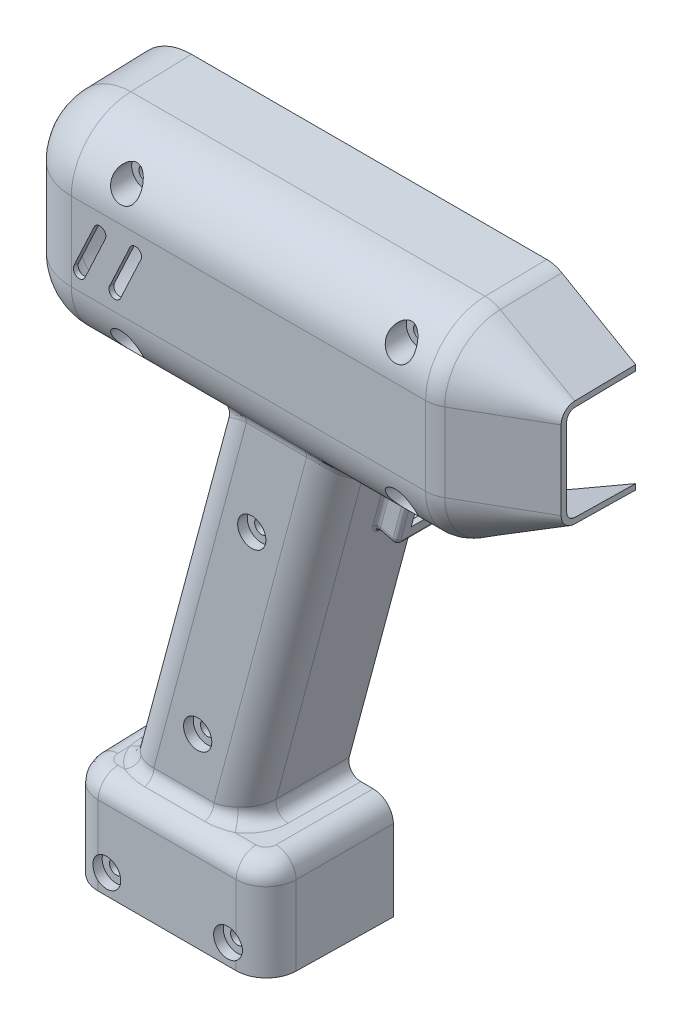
SolidWorks part; units mm, degrees
ref_plane "Ebene vorne" through (0, 0, 0) normal (0, 0, 1) x (1, 0, 0)
ref_plane "Ebene oben" through (0, 0, 0) normal (0, 1, 0) x (1, 0, 0)
ref_plane "Ebene rechts" through (0, 0, 0) normal (1, 0, 0) x (0, 0, -1)
sketch "Skizze1" plane through (0, 0, 0) normal (0, 0, 1) x (1, 0, 0)
  line L0 (55, 0) -> (-55, 0) construction
  line L1 (-25, 0) -> (25, 0)
  line L2 (-25, 0) -> (-25, 25)
  line L3 (-25, 25) -> (25, 25)
  line L4 (25, 0) -> (25, 25)
  line L5 (0, -9.5998) -> (0, 35.5758) construction
  line L6 (0, -55) -> (0, 55) construction
  dimension "D1" = 50
  dimension "D2" = 25
extrude "Aufsatz-Linear austragen1" add sketch "Skizze1" along normal blind 31
sketch "Skizze2" plane through (0, 0, 0) normal (0, 0, 1) x (1, 0, 0)
  line L0 (25, 25) -> (-25, 25) construction
  line L1 (-18, 25) -> (13.0583, 25)
  line L2 (-18, 25) -> (4.7757, 110)
  line L3 (4.7757, 110) -> (35.834, 110)
  line L4 (13.0583, 25) -> (35.834, 110)
  line L5 (0, -13.75) -> (0, 13.75) construction
  dimension "D1" = 30
  dimension "D2" = 85
  dimension "D3" = 18
  dimension "D4" = 75
extrude "Aufsatz-Linear austragen2" add sketch "Skizze2" along normal blind 25
sketch "Skizze3" plane through (0, 0, 0) normal (0, 0, 1) x (1, 0, 0)
  line L2 (35.834, 110) -> (4.7757, 110) construction
  line L3 (-40, 110) -> (85, 110)
  line L4 (-40, 110) -> (-40, 160)
  line L7 (-40, 160) -> (85, 160)
  line L8 (85, 110) -> (85, 160)
  line L9 (0, -13.75) -> (0, 13.75) construction
  dimension "D1" = 50
  dimension "D2" = 85
  dimension "D3" = 40
extrude "Aufsatz-Linear austragen3" add sketch "Skizze3" along normal blind 30
sketch "Skizze4" plane through (5.9335, -1.5899, 0) normal (0.9659, -0.2588, 0) x (0, 0, -1)
  line L0 (0, 68.75) -> (0, -68.75) construction
  line L1 (0, 95.6186) -> (-10, 95.6186)
  line L2 (0, 95.6186) -> (0, 120.6186)
  line L3 (0, 120.6186) -> (-10, 120.6186)
  line L4 (-10, 95.6186) -> (-10, 120.6186)
  line L5 (-31, 30.6186) -> (0, 30.6186) construction
  point P6 (0, 108.1186)
  dimension "D1" = 10
  dimension "D2" = 25
  dimension "D3" = 65
extrude "Aufsatz-Linear austragen4" add sketch "Skizze4" along normal blind 5
draft "Formschräge1" type of draft neutral plane draft angle 1 faces to draft 8 parameters "D1"=1
fillet "Verrundung1" radius 15 2 edges at (22.7618, 159.4763, 30) (22.7618, 110.5237, 30)
fillet "Verrundung2" radius 15 5 edges at (-39.8668, 159.8668, 7.6309) (-39.5514, 155.2495, 25.6988) (-39.8668, 110.1332, 7.6309) (-39.5514, 114.7505, 25.6988) (-39.4763, 135, 30)
chamfer "Fase1" distance 20 angle 30 5 edges at (85, 110.1332, 7.6309) (85, 159.8668, 7.6309) (85, 114.7505, 25.6988) (85, 155.2495, 25.6988) (85, 135, 30)
fillet "Verrundung4" radius 7.5 5 edges at (65, 110.1332, 7.6309) (65, 114.7505, 25.6988) (65, 159.8668, 7.6309) (65, 155.2495, 25.6988) (65, 135, 30)
fillet "Verrundung3" radius 7.5 4 edges at (-5.6717, 69.3237, 25) (24.483, 69.3237, 25) (-24.4589, 12.2294, 31) (24.4589, 12.2294, 31)
fillet "Verrundung5" radius 5 5 edges at (-24.7938, 24.7938, 11.8154) (-22.3455, 24.4964, 28.8494) (0, 24.4589, 31) (22.3455, 24.4964, 28.8494) (24.7938, 24.7938, 11.8154)
fillet "Verrundung6" radius 3 12 edges at (-17.8819, 24.8461, 8.8154) (-15.4671, 24.6012, 22.8494) (-2.5878, 24.5636, 25) (10.3117, 24.6012, 22.8494) (12.8578, 24.8461, 8.8154) (35.6648, 110.2205, 12.6309) (35.6263, 110.3344, 16.4509) (33.9697, 112.4043, 22.7218) (21.3991, 114.0838, 25) (6.9878, 111.8847, 21.7817) (5.1626, 110.3344, 16.4509) (4.9493, 110.1332, 7.6309)
fillet "Verrundung7" radius 1.5 1 edges at (33.012, 90.1461, 10)
fillet "Verrundung8" radius 1 3 edges at (35.5111, 89.4765, 4.25) (35.6248, 89.9009, 9.5607) (38.4782, 100.55, 10)
fillet "Verrundung9" radius 1 7 edges at (41.0314, 110.0785, 4.5) (40.7525, 110.1694, 9.7071) (39.0118, 110.1746, 10) (36.1756, 109.5547, 10) (30.6098, 90.7898, 4.25) (30.634, 91.2382, 9.5607) (33.0027, 100.108, 10)
shell "Schale1" thickness 1.2
sketch "Skizze5" plane through (0, 0, 30) normal (0, 0, 1) x (1, 0, 0)
  line L0 (-22.7539, 129.4969) -> (-17.6824, 140.3726) construction
  line L1 (-24.1133, 130.1308) -> (-19.0419, 141.0065)
  line L2 (-21.3944, 128.863) -> (-16.323, 139.7387)
  line L3 (-13.9268, 129.4969) -> (-8.8554, 140.3726) construction
  line L4 (-15.2863, 130.1308) -> (-10.2149, 141.0065)
  line L5 (-12.5674, 128.863) -> (-7.4959, 139.7387)
  line L6 (-48.7499, 134.9347) -> (25.9677, 134.9347) construction
  arc A0 (-24.1133, 130.1308) -> (-21.3944, 128.863) centre (-22.7539, 129.4969) ccw
  arc A1 (-16.323, 139.7387) -> (-19.0419, 141.0065) centre (-17.6824, 140.3726) ccw
  arc A2 (-15.2863, 130.1308) -> (-12.5674, 128.863) centre (-13.9268, 129.4969) ccw
  arc A3 (-7.4959, 139.7387) -> (-10.2149, 141.0065) centre (-8.8554, 140.3726) ccw
  point P2 (-20.2181, 134.9347)
  point P7 (-11.3911, 134.9347)
  dimension "D1" = 12
  dimension "D2" = 12
  dimension "D3" = 8
  dimension "D4" = 3
  dimension "D5" = 3
  dimension "D6" = 65
extrude "Schnitt-Linear austragen1" cut sketch "Skizze5" against normal up to surface (1.2 mm away)
sketch "Skizze6" plane through (10.7632, -2.884, 0) normal (0.9659, -0.2588, 0) x (0, 0, -1)
  line L0 (0, 96.6186) -> (0, 116.0986) construction
  line L1 (0, 99.1186) -> (-7, 99.1186)
  line L2 (0, 99.1186) -> (0, 115.1617)
  line L3 (0, 115.1617) -> (-7, 115.1617)
  line L4 (-7, 99.1186) -> (-7, 115.1617)
  line L5 (-8.5, 96.6186) -> (0, 96.6186) construction
  line L6 (0, 116.0986) -> (-9, 116.2613) construction
  point P6 (0, 107.1402)
  point P9 (-3.5, 99.1186)
  point P12 (-3.5, 115.1617)
  dimension "D1" = 7
  dimension "D2" = 2.5
  dimension "D3" = 1
extrude "Schnitt-Linear austragen2" cut sketch "Skizze6" against normal up to surface (1.2 mm away)
sketch "Skizze7" plane through (0, 0, 0) normal (0, 0, -1) x (-1, 0, 0)
  line L0 (-71.6404, 152) -> (97.6404, 152) construction
  line L1 (-66.1404, 118) -> (-43.8596, 118) construction
  line L2 (-66.1404, 125.2641) -> (-66.1404, 112.3101) construction
  line L3 (-3.721, 48.1082) -> (-26.1707, 131.8918) construction
  line L4 (-33.6495, 5) -> (48.32, 5) construction
  line L5 (-5.5903, 27.2914) -> (-28.506, 112.8142) construction
  line L6 (-13.6117, 112.8142) -> (9.304, 27.2914) construction
  line L7 (17.05, 0) -> (-17.05, 0) construction
  line L8 (-96.83, 135) -> (59.0566, 135) construction
  line L9 (-62.9904, 144.7359) -> (24.7359, 144.7359) construction
  line L10 (24.7359, 125.2641) -> (-62.9904, 125.2641) construction
  line L11 (0, 17.05) -> (0, -17.05) construction
  circle A0 centre (-55, 152) radius 4.5
  circle A1 centre (-55, 118) radius 4.5
  circle A2 centre (13, 118) radius 4.5
  circle A3 centre (13, 152) radius 4.5
  circle A4 centre (-14.9458, 90) radius 4.5
  circle A5 centre (-1.5484, 40) radius 4.5
  circle A6 centre (-15, 5) radius 4.5
  circle A7 centre (15, 5) radius 4.5
  point P40 (0, 0)
  dimension "D7" = 9
  dimension "D9" = 5
  dimension "D10" = 17
  dimension "D11" = 17
  dimension "D12" = 55
  dimension "D13" = 55
  dimension "D14" = 13
  dimension "D15" = 13
  dimension "D16" = 90
  dimension "D17" = 40
  dimension "D18" = 15
  dimension "D19" = 15
extrude "Aufsatz-Linear austragen5" add sketch "Skizze7" against normal up to next
sketch "Skizze23" plane through (0, 0, 0) normal (0, 0, 1) x (1, 0, 0)
  circle A0 centre (15, 5) radius 4.5 construction
  circle A1 centre (-15, 5) radius 4.5 construction
  circle A2 centre (1.5484, 40) radius 4.5 construction
  circle A3 centre (14.9458, 90) radius 4.5 construction
  circle A4 centre (-13, 118) radius 4.5 construction
  circle A5 centre (55, 118) radius 4.5 construction
  circle A6 centre (-13, 152) radius 4.5 construction
  circle A7 centre (55, 152) radius 4.5 construction
  circle A56 centre (15, 5) radius 4.5
  circle A57 centre (-15, 5) radius 4.5
  circle A58 centre (1.5484, 40) radius 4.5
  circle A59 centre (14.9458, 90) radius 4.5
  circle A60 centre (-13, 118) radius 4.5
  circle A61 centre (55, 118) radius 4.5
  circle A62 centre (-13, 152) radius 4.5
  circle A63 centre (55, 152) radius 4.5
  circle A64 centre (15, 5) radius 2.6
  circle A65 centre (-15, 5) radius 2.6
  circle A66 centre (1.5484, 40) radius 2.6
  circle A67 centre (14.9458, 90) radius 2.6
  circle A68 centre (-13, 118) radius 2.6
  circle A69 centre (55, 118) radius 2.6
  circle A70 centre (-13, 152) radius 2.6
  circle A71 centre (55, 152) radius 2.6
  dimension "D1" = 1.9
extrude "Schnitt-Linear austragen8" cut sketch "Skizze23" along normal blind 18
draft "Formschräge2" type of draft neutral plane draft angle 1 faces to draft 8 parameters "D1"=1
fillet "Verrundung15" radius 0.5 12 edges at (50.4242, 153.868, 25.3462) (-17.5758, 153.868, 25.3462) (50.2036, 119.3375, 27.4626) (-17.7964, 119.3375, 27.4626) (10.0304, 90, 23.8) (-3.367, 40, 23.8) (19.9342, 5.8581, 29.1207) (-19.9342, 4.1419, 29.1207) (10.1478, 6.2876, 29.8) (16.2876, 0.1478, 29.8) (-16.2876, 0.1478, 29.8) (-10.1478, 6.2876, 29.8)
sketch "Skizze8" plane through (0, 0, 0) normal (0, 0, -1) x (-1, 0, 0)
  circle A0 centre (-15, 5) radius 1.5
  circle A1 centre (15, 5) radius 1.5
  circle A2 centre (-1.5484, 40) radius 1.5
  circle A3 centre (-14.9458, 90) radius 1.5
  circle A4 centre (13, 118) radius 1.5
  circle A5 centre (13, 152) radius 1.5
  circle A6 centre (-55, 118) radius 1.5
  circle A7 centre (-55, 152) radius 1.5
  circle A9 centre (-55, 152) radius 4.5 construction
  dimension "D1" = 3
  dimension "D2" = 3
  dimension "D3" = 3
  dimension "D4" = 3
  dimension "D5" = 3
  dimension "D6" = 3
  dimension "D7" = 3
  dimension "D8" = 3
extrude "Schnitt-Linear austragen3" cut sketch "Skizze8" against normal through all both and the other way through all
hole_wizard "Stirnsenkung für M3 Flachkopfschraube mit Schlitz3" positions "Skizze10" profile "Skizze11" counterbore size "M3" standard "DIN"
sketch "Skizze10" plane through (0, 0, 31) normal (0, 0, 1) x (1, 0, 0)
  point P0 (-15, 5)
  point P3 (15, 5)
sketch "Skizze11" plane through (-15, 5, 31) normal (1, 0, 0) x (0, -1, 0)
  line L0 (0, 0) -> (0, 31)
  line L1 (0, 31) -> (1.7, 31)
  line L3 (1.7, 31) -> (1.7, 2.4)
  line L4 (1.7, 2.4) -> (3.5, 2.4)
  line L5 (3.5, 2.4) -> (3.5, 0)
  line L7 (3.5, 0) -> (0, 0)
  line L11 (0, -6.35) -> (0, 107.95) construction
  dimension "Bohrerdurchmesser" = 3.4
  dimension "Bohrungstiefe" = 31
  dimension "Senkdurchmesser2" = 7
  dimension "Senktiefe2" = 2.4
hole_wizard "Stirnsenkung für M3 Flachkopfschraube mit Schlitz2" positions "Skizze12" profile "Skizze13" counterbore size "M3" standard "DIN"
sketch "Skizze12" plane through (0, 0, 25) normal (0, 0, 1) x (1, 0, 0)
  point P0 (14.9458, 90)
  point P3 (1.5484, 40)
sketch "Skizze13" plane through (14.9458, 90, 25) normal (1, 0, 0) x (0, -1, 0)
  line L0 (0, 0) -> (0, 25)
  line L1 (0, 25) -> (1.7, 25)
  line L3 (1.7, 25) -> (1.7, 2.4)
  line L4 (1.7, 2.4) -> (3.5, 2.4)
  line L5 (3.5, 2.4) -> (3.5, 0)
  line L7 (3.5, 0) -> (0, 0)
  line L11 (0, -6.35) -> (0, 107.95) construction
  dimension "Bohrerdurchmesser" = 3.4
  dimension "Bohrungstiefe" = 25
  dimension "Senkdurchmesser2" = 7
  dimension "Senktiefe2" = 2.4
hole_wizard "Stirnsenkung für M3 Flachkopfschraube mit Schlitz1" positions "Skizze14" profile "Skizze16" counterbore size "M3" standard "DIN"
sketch "Skizze14" plane through (0, 0, 30) normal (0, 0, 1) x (1, 0, 0)
  point P0 (55, 118)
  point P3 (55, 152)
  point P6 (-13, 118)
  point P9 (-13, 152)
sketch "Skizze16" plane through (55, 118, 30) normal (1, 0, 0) x (0, -1, 0)
  line L0 (0, 0) -> (0, 30)
  line L1 (0, 30) -> (1.7, 30)
  line L3 (1.7, 30) -> (1.7, 6.7)
  line L4 (1.7, 6.7) -> (3.5, 6.7)
  line L5 (3.5, 6.7) -> (3.5, 0)
  line L7 (3.5, 0) -> (0, 0)
  line L11 (0, -6.35) -> (0, 107.95) construction
  dimension "Bohrerdurchmesser" = 3.4
  dimension "Bohrungstiefe" = 30
  dimension "Senkdurchmesser2" = 7
  dimension "Senktiefe2" = 6.7
sketch "Skizze17" plane through (0, 0, 0) normal (0, 0, -1) x (-1, 0, 0)
  line L0 (-41.7777, 110) -> (-62.9904, 110) construction
  line L1 (-47, 110) -> (-45, 110)
  line L2 (-47, 110) -> (-47, 158.7998)
  line L3 (-47, 158.7998) -> (-45, 158.7998)
  line L4 (-45, 110) -> (-45, 158.7998)
  line L5 (-62.9904, 158.7998) -> (25.0019, 158.7998) construction
  line L6 (25.0023, 110) -> (-0.8666, 110) construction
  line L7 (2, 110) -> (0, 110)
  line L8 (2, 110) -> (2, 160)
  line L9 (2, 160) -> (0, 160)
  line L10 (0, 110) -> (0, 160)
  line L11 (0, 17.05) -> (0, -17.05) construction
  line L12 (-62.9904, 160) -> (25.0023, 160) construction
  line L13 (-25, 0) -> (-25, 20.0008) construction
  line L14 (-25, 12) -> (25, 12)
  line L15 (-25, 12) -> (-25, 14)
  line L16 (-25, 14) -> (25, 14)
  line L17 (25, 12) -> (25, 14)
  line L18 (17.05, 0) -> (-17.05, 0) construction
  line L19 (25, 20.0008) -> (25, 0) construction
  line L21 (-19.757, 50) -> (10.7654, 50)
  line L22 (-19.757, 50) -> (-19.757, 52)
  line L23 (-19.757, 52) -> (10.7654, 52)
  line L24 (10.7654, 50) -> (10.7654, 52)
  line L25 (-3.7639, 106.2241) -> (17.4058, 27.2175) construction
  line L26 (-27.7955, 80) -> (2.7269, 80)
  line L27 (-27.7955, 80) -> (-27.7955, 82)
  line L28 (-27.7955, 82) -> (2.7269, 82)
  line L29 (2.7269, 80) -> (2.7269, 82)
  line L30 (-14.07, 28.7759) -> (-30.4226, 89.8047) construction
  point P26 (25, 13)
  dimension "D1" = 2
  dimension "D2" = 2
  dimension "D3" = 2
  dimension "D4" = 45
  dimension "D5" = 12
  dimension "D6" = 0
  dimension "D7" = 50
  dimension "D8" = 80
  dimension "D9" = 2
  dimension "D10" = 2
extrude "Aufsatz-Linear austragen6" add sketch "Skizze17" against normal up to next
sketch "Skizze19" plane through (0, 12, 0) normal (0, -1, 0) x (1, 0, 0)
  line L1 (0, -6) -> (0, 10) construction
  line L2 (0, -17.05) -> (0, 17.05) construction
  line L3 (-9.5, -6) -> (-9.5, 10)
  line L4 (9.5, -6) -> (9.5, 10)
  line L5 (68.75, 0) -> (-68.75, 0) construction
  arc A0 (-9.5, -6) -> (9.5, -6) centre (0, -6) ccw
  arc A1 (9.5, 10) -> (-9.5, 10) centre (0, 10) ccw
  point P4 (0, 2)
  dimension "D1" = 19
  dimension "D2" = 10
  dimension "D3" = 6
extrude "Schnitt-Linear austragen4" cut sketch "Skizze19" against normal up to surface (2 mm away)
sketch "Skizze20" plane through (-2, 0, 0) normal (-1, 0, 0) x (0, 0, 1)
  line L0 (0, 133.5) -> (0, 136.5) construction
  line L1 (0, 111.2002) -> (0, 158.7998) construction
  line L2 (-18, 133.5) -> (-18, 136.5)
  line L3 (18, 133.5) -> (18, 136.5)
  line L4 (32.7029, 135) -> (-32.7029, 135) construction
  line L5 (15.2408, 111.4662) -> (0, 111.2002) construction
  line L6 (0, 158.7998) -> (15.2408, 158.5338) construction
  arc A0 (-18, 133.5) -> (18, 133.5) centre (0, 133.5) ccw
  arc A1 (18, 136.5) -> (-18, 136.5) centre (0, 136.5) ccw
  point P4 (0, 135)
  dimension "D1" = 3
  dimension "D2" = 18
extrude "Schnitt-Linear austragen5" cut sketch "Skizze20" against normal up to surface (49 mm away)
sketch "Skizze21" plane through (0, 82, 0) normal (0, 1, 0) x (1, 0, 0)
  line L0 (-1.4844, 0) -> (27.0889, 0) construction
  circle A0 centre (12.8022, 0) radius 10
  dimension "D1" = 20
extrude "Schnitt-Linear austragen6" cut sketch "Skizze21" against normal up to surface (2 mm away)
sketch "Skizze22" plane through (0, 52, 0) normal (0, 1, 0) x (1, 0, 0)
  line L1 (-9.5229, 0) -> (19.0504, 0) construction
  circle A0 centre (4.7638, 0) radius 10
  dimension "D1" = 20
extrude "Schnitt-Linear austragen7" cut sketch "Skizze22" against normal up to surface (2 mm away)
draft "Formschräge3" type of draft neutral plane draft angle 0.5 faces to draft 10 parameters "D1"=0.5
fillet "Verrundung16" radius 1 50 edges at (23.5938, 11.897, 11.805) (21.5044, 11.7557, 27.9935) (0, 11.7399, 29.8) (-21.5044, 11.7557, 27.9935) (18.3348, 49.9232, 8.805) (16.1951, 49.8081, 21.9935) (4.1722, 49.7923, 23.8) (-7.8422, 49.8081, 21.9935) (26.3733, 79.9232, 8.805) (24.2336, 79.8081, 21.9935) (12.2107, 79.7923, 23.8) (0.1963, 79.8081, 21.9935) (23.5938, 14.103, 11.805) (21.5044, 14.2443, 27.9935) (0, 14.2601, 29.8) (-21.5044, 14.2443, 27.9935) (18.9119, 52.0768, 8.805) (16.8338, 52.1919, 21.9935) (4.8194, 52.2077, 23.8) (-7.2034, 52.1919, 21.9935) (26.9503, 82.0768, 8.805) (24.8723, 82.1919, 21.9935) (12.8579, 82.2077, 23.8) (0.835, 82.1919, 21.9935) (0.0665, 158.6668, 7.6204) (0.2168, 154.4084, 24.8429) (0.2513, 135, 28.8) (0.2168, 115.5916, 24.8429) (-2.0665, 158.6668, 7.6204) (-2.2168, 154.4084, 24.8429) (-2.2513, 135, 28.8) (-2.2168, 115.5916, 24.8429) (44.9335, 158.6668, 7.6204) (44.7832, 154.4084, 24.8429) (44.7487, 135, 28.8) (44.7832, 115.5916, 24.8429) (47.0665, 158.6668, 7.6204) (47.2168, 154.4084, 24.8429) (47.2513, 135, 28.8) (47.2168, 115.5916, 24.8429) (-23.5938, 11.897, 11.805) (-9.9202, 49.9232, 8.805) (-1.8817, 79.9232, 8.805) (-23.5938, 14.103, 11.805) (-9.3431, 52.0768, 8.805) (-1.3047, 82.0768, 8.805) (0.0665, 111.3332, 7.6204) (-2.0665, 111.3332, 7.6204) (44.9335, 111.3332, 7.6204) (47.0665, 111.3332, 7.6204)
